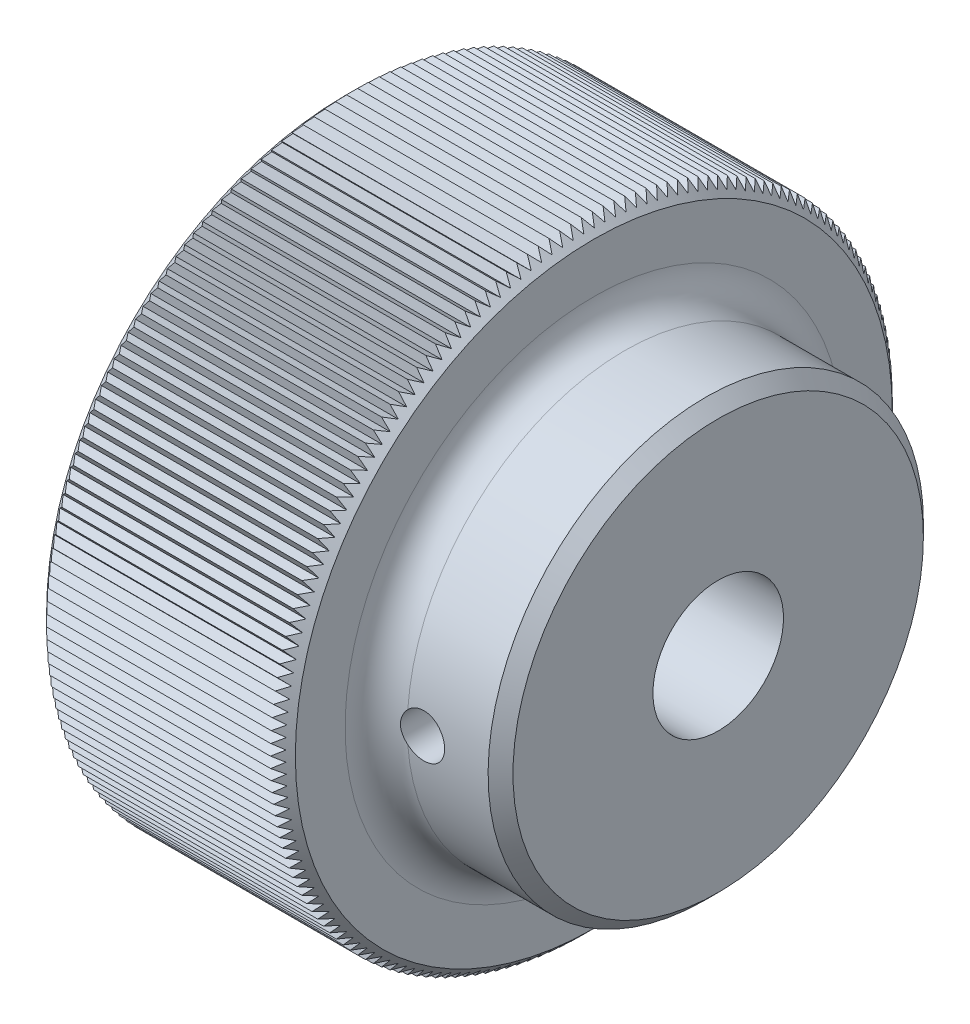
SolidWorks part; units mm, degrees
ref_plane "Front Plane" through (0, 0, 0) normal (0, 0, 1) x (1, 0, 0)
ref_plane "Top Plane" through (0, 0, 0) normal (0, 1, 0) x (1, 0, 0)
ref_plane "Right Plane" through (0, 0, 0) normal (1, 0, 0) x (0, 0, -1)
sketch "Sketch1" plane through (0, 0, 0) normal (1, 0, 0) x (0, 0, -1)
  circle A0 centre (0, 0) radius 10
  dimension "D1" = 20
extrude "Extrude1" add sketch "Sketch1" against normal blind 8
chamfer "Chamfer1" distance 0.4 angle 45 2 edges at (-8, 0, -10) (0, 0, -10)
sketch "Sketch2" plane through (0, 0, 0) normal (1, 0, 0) x (0, 0, -1)
  line L0 (0, 0) -> (0, 50000) construction
  line L1 (0, 0) -> (-872.6203, 49992.3848) construction
  line L2 (0, 10) -> (-0.1702, 9.75)
  line L3 (-0.349, 9.9939) -> (-0.1702, 9.75)
  circle A0 centre (0, 0) radius 10 construction
  arc A1 (-0.349, 9.9939) -> (0, 10) centre (-0.1766, 10.1203) cw
  dimension "D1" = 1
  dimension "D2" = 0.25
extrude "Extrude2" cut sketch "Sketch2" against normal through all
pattern_circular "CirPattern1" count 180 over 360 about axis through (0, 0, 0) along (1, 0, 0) of "Extrude2"
sketch "Sketch3" plane through (0, 0, 0) normal (1, 0, 0) x (0, 0, -1)
  circle A0 centre (0, 0) radius 7
  dimension "D1" = 14
extrude "Extrude3" add sketch "Sketch3" along normal blind 4
fillet "Fillet1" radius 1 1 edges at (0, 0, -7)
sketch "Sketch4" plane through (-8, 0, 0) normal (-1, 0, 0) x (0, 0, 1)
  circle A0 centre (0, 0) radius 2.1
  dimension "D1" = 4.2
extrude "Extrude4" cut sketch "Sketch4" against normal through all
sketch "Sketch5" plane through (-8, 0, 0) normal (-1, 0, 0) x (0, 0, 1)
  circle A0 centre (0, 0) radius 7.5
  dimension "D1" = 15
extrude "Extrude5" cut sketch "Sketch5" against normal blind 5
chamfer "Chamfer2" distance 0.4 angle 45 3 edges at (-8, 0, 7.5) (4, 0, -7) (-3, 0, 2.1)
sketch "Sketch6" plane through (0, 0, 0) normal (0, 0, 1) x (1, 0, 0)
  line L0 (4, -6.6) -> (4, 6.6) construction
  circle A0 centre (1.5, 0) radius 0.7
  dimension "D1" = 1.4
  dimension "D2" = 2.5
extrude "Extrude6" cut sketch "Sketch6" along normal through all
